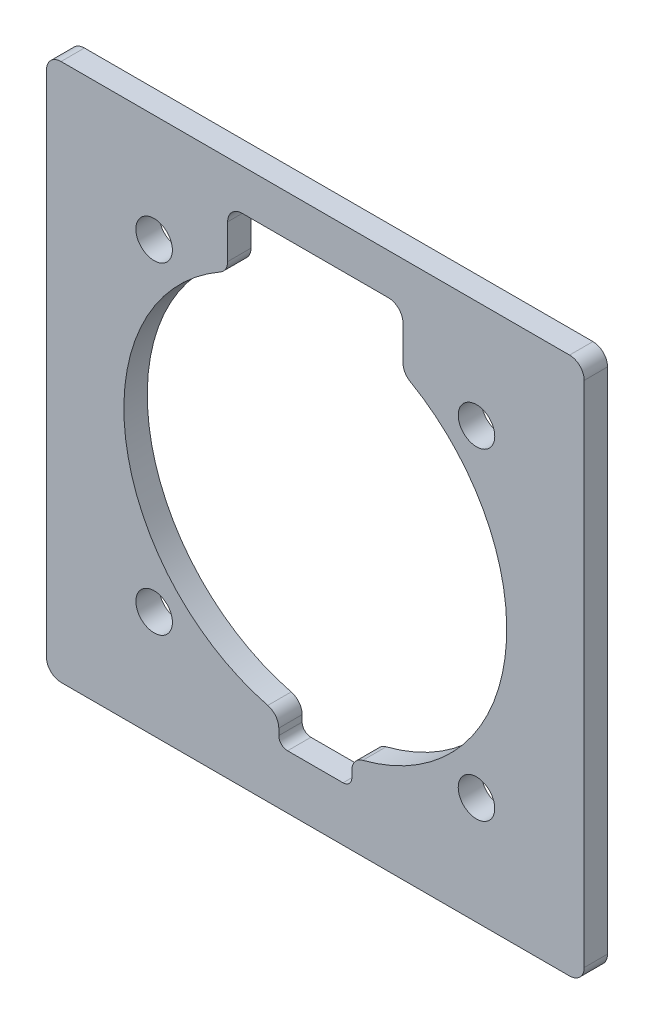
SolidWorks part; units mm, degrees
ref_plane "Plan de face" through (0, 0, 0) normal (0, 0, 1) x (1, 0, 0)
ref_plane "Plan de dessus" through (0, 0, 0) normal (0, 1, 0) x (1, 0, 0)
ref_plane "Plan de droite" through (0, 0, 0) normal (1, 0, 0) x (0, 0, -1)
sketch "Esquisse1" plane through (0, 0, 0) normal (0, 0, 1) x (1, 0, 0)
  line L0 (-92, 87) -> (-92, -87)
  line L1 (-87, -92) -> (87, -92)
  line L2 (-87, 92) -> (87, 92)
  line L3 (25, 78) -> (-25, 78)
  line L4 (0, 92) -> (0, -92) construction
  line L5 (92, 0) -> (-92, 0) construction
  line L6 (-30, 73) -> (-30, 61.1984)
  line L7 (-12.5, -68.2935) -> (-12.5, -70.5)
  line L8 (-9.5, -73.5) -> (9.5, -73.5)
  line L9 (12.5, -68.2935) -> (12.5, -70.5)
  line L10 (30, 73) -> (30, 61.1984)
  line L11 (92, 87) -> (92, -87)
  arc A0 (-92, -87) -> (-87, -92) centre (-87, -87) ccw
  circle A1 centre (-55.15, 55.15) radius 6.25
  arc A2 (-92, 87) -> (-87, 92) centre (-87, 87) cw
  circle A3 centre (-55.15, -55.15) radius 6.25
  arc A4 (-32.5177, 56.8581) -> (-16.2589, -63.45) centre (0, 0) ccw
  arc A5 (-30, 73) -> (-25, 78) centre (-25, 73) cw
  arc A6 (-32.5177, 56.8581) -> (-30, 61.1984) centre (-35, 61.1984) ccw
  arc A7 (-12.5, -68.2935) -> (-16.2589, -63.45) centre (-17.5, -68.2935) ccw
  arc A8 (-9.5, -73.5) -> (-12.5, -70.5) centre (-9.5, -70.5) cw
  arc A9 (9.5, -73.5) -> (12.5, -70.5) centre (9.5, -70.5) ccw
  arc A10 (12.5, -68.2935) -> (16.2589, -63.45) centre (17.5, -68.2935) cw
  arc A11 (32.5177, 56.8581) -> (30, 61.1984) centre (35, 61.1984) cw
  arc A12 (30, 73) -> (25, 78) centre (25, 73) ccw
  arc A13 (32.5177, 56.8581) -> (16.2589, -63.45) centre (0, 0) cw
  circle A14 centre (55.15, -55.15) radius 6.25
  arc A15 (92, 87) -> (87, 92) centre (87, 87) ccw
  circle A16 centre (55.15, 55.15) radius 6.25
  arc A17 (92, -87) -> (87, -92) centre (87, -87) cw
  point P22 (0, 78)
  point P52 (0, -73.5)
  dimension "D5" = 12.5
  dimension "D6" = 5
  dimension "D7" = 151.5
  dimension "D8" = 65.5
  dimension "D11" = 5
  dimension "D12" = 3
  dimension "D1" = 184
  dimension "D2" = 184
  dimension "D3" = 110.3
  dimension "D4" = 110.3
  dimension "D9" = 25
  dimension "D10" = 60
  dimension "D13" = 78
extrude "Extrusion1" add sketch "Esquisse1" along normal blind 8
